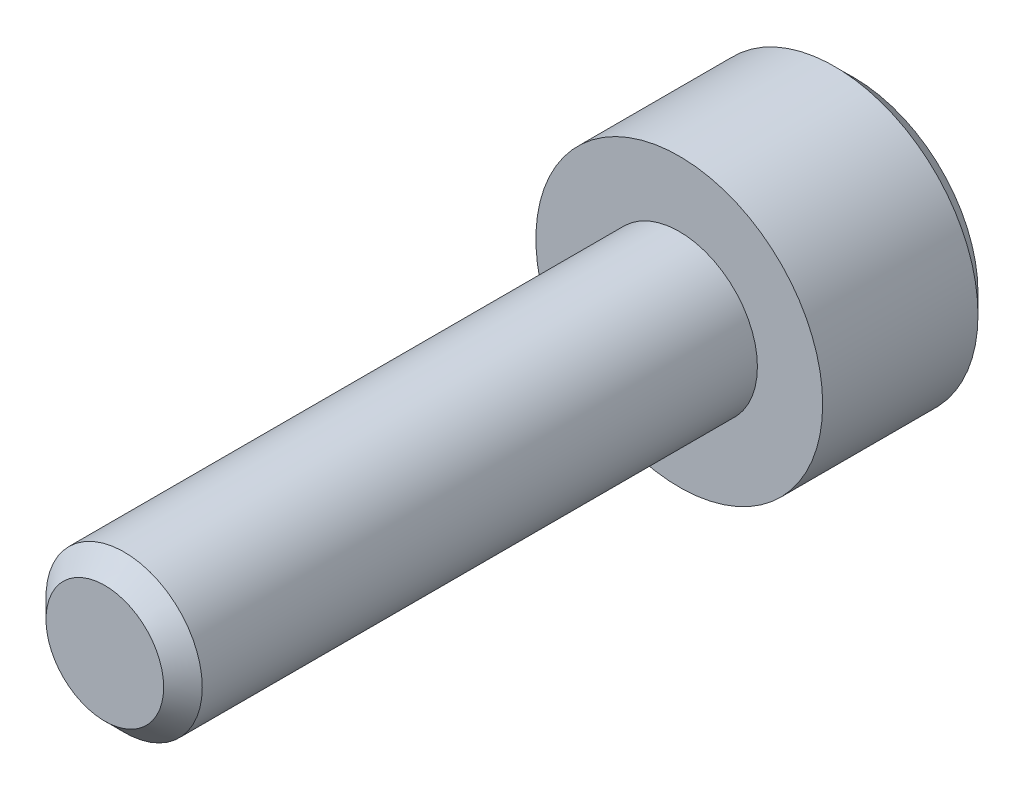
SolidWorks part; units mm, degrees
ref_plane "Front Plane" through (0, 0, 0) normal (0, 0, 1) x (1, 0, 0)
ref_plane "Top Plane" through (0, 0, 0) normal (0, 1, 0) x (1, 0, 0)
ref_plane "Right Plane" through (0, 0, 0) normal (1, 0, 0) x (0, 0, -1)
sketch "Sketch1" plane through (0, 0, 0) normal (0, 1, 0) x (1, 0, 0)
  line L0 (0, -15.875) -> (2.159, -15.875)
  line L1 (2.159, -15.875) -> (2.159, 0)
  line L2 (2.159, 0) -> (3.9624, 0)
  line L3 (3.9624, 0) -> (3.9624, 4.826)
  line L4 (3.9624, 4.826) -> (0, 4.826)
  line L5 (0, -15.875) -> (0, 0)
  line L6 (0, 0) -> (0, 4.826)
  dimension "D1" = 2.159
  dimension "D2" = 3.9624
  dimension "D3" = 4.826
  dimension "D4" = 15.875
revolve "Revolve1" add sketch "Sketch1" angle 360 about L5
sketch "Sketch2" plane through (0, 0, -4.826) normal (0, 0, -1) x (-1, 0, 0)
  line L1 (-1.9891, -1.1375) -> (-0.0095, -2.2913)
  line L2 (-0.0095, -2.2913) -> (1.9796, -1.1539)
  line L3 (1.9796, -1.1539) -> (1.9891, 1.1375)
  line L4 (1.9891, 1.1375) -> (0.0095, 2.2913)
  line L5 (0.0095, 2.2913) -> (-1.9796, 1.1539)
  line L6 (-1.9796, 1.1539) -> (-1.9891, -1.1375)
  circle A0 centre (0, 0) radius 1.9844 construction
  circle A1 centre (0, 0) radius 3.9624 construction
  dimension "D1" = 3.9688
extrude "Cut-Extrude1" cut sketch "Sketch2" against normal blind 4.699
chamfer "Chamfer2" distance 0.5334 angle 45 1 edges at (3.9624, 0, -4.826)
chamfer "Chamfer3" distance 0.5334 angle 45 1 edges at (2.159, 0, 15.875)
